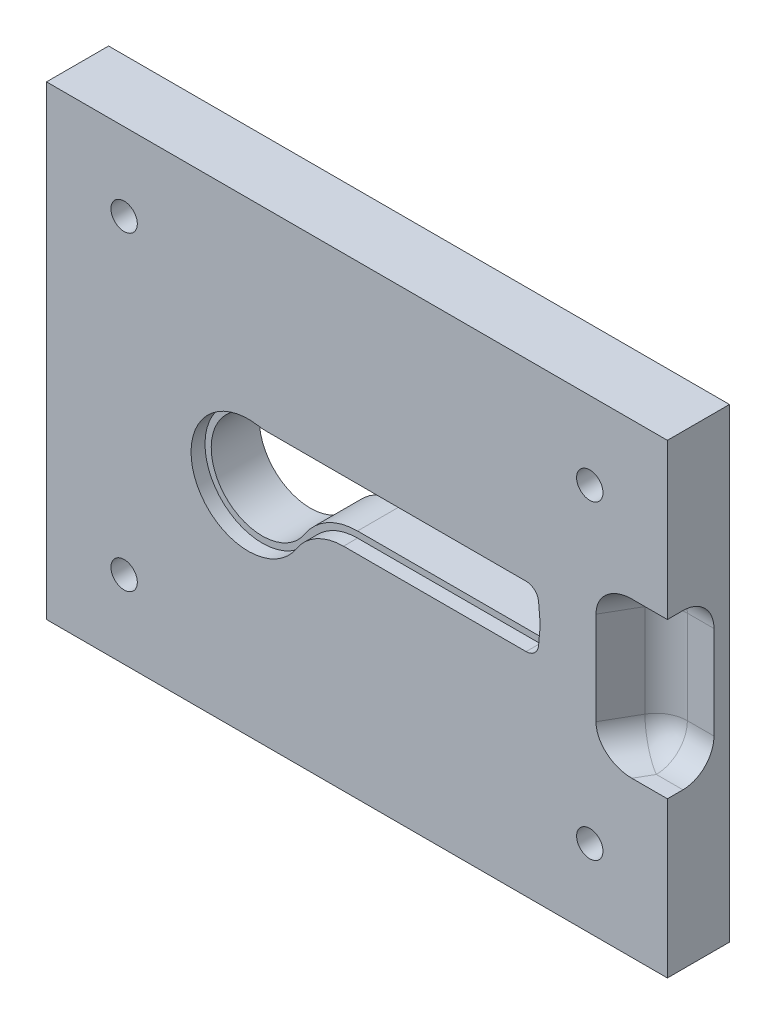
SolidWorks part; units mm, degrees
ref_plane "Plan1" through (0, 0, 0) normal (0, 0, 1) x (1, 0, 0)
ref_plane "Plan2" through (0, 0, 0) normal (0, 1, 0) x (1, 0, 0)
ref_plane "Plan3" through (0, 0, 0) normal (1, 0, 0) x (0, 0, -1)
sketch "Esquisse1" plane through (0, 0, 0) normal (0, 0, 1) x (1, 0, 0)
  line L1 (0, 0) -> (200, 0)
  line L2 (0, 0) -> (0, 150)
  line L3 (0, 150) -> (200, 150)
  line L4 (200, 0) -> (200, 150)
  dimension "D1" = 150
  dimension "D2" = 200
extrude "Base-Extrusion" add sketch "Esquisse1" along normal blind 20
sketch "Esquisse2" plane through (0, 0, 20) normal (0, 0, 1) x (1, 0, 0)
  line L0 (-10, 70) -> (90, 70) construction
  line L1 (0, 0) -> (200, 0) construction
  line L2 (20.3045, 78.12) -> (209.4484, 78.12) construction
  line L3 (71.0782, 85.935) -> (154.4898, 85.935)
  line L4 (156.5121, 84.0819) -> (157.0337, 78.12)
  line L5 (156.5121, 72.1581) -> (157.0337, 78.12)
  line L6 (95.6814, 70.305) -> (154.4898, 70.305)
  line L7 (200, 0) -> (200, 150) construction
  arc A0 (67.7404, 86.2151) -> (78.8329, 61.1069) centre (65, 70) ccw
  arc A1 (154.4898, 85.935) -> (156.5121, 84.0819) centre (154.4898, 83.905) cw
  arc A2 (71.0782, 85.935) -> (67.7404, 86.2151) centre (71.0782, 105.965) cw
  arc A3 (154.4898, 70.305) -> (156.5121, 72.1581) centre (154.4898, 72.335) ccw
  arc A4 (95.6814, 70.305) -> (78.8329, 61.1069) centre (95.6814, 50.275) ccw
  point P13 (156.35, 85.935)
  dimension "D2" = 32.89
  dimension "D6" = 91.35
  dimension "D7" = 2.03
  dimension "D8" = 20.03
  dimension "D9" = 20.03
  dimension "D10" = 135
  dimension "D1" = 70
  dimension "D3" = 8.12
  dimension "D4" = 7.815
  dimension "D5" = 95
extrude "Enlèv. mat.-Extru.1" cut sketch "Esquisse2" against normal through all
sketch "Esquisse10" plane through (0, 0, 20) normal (0, 0, 1) x (1, 0, 0)
  line L8 (158.5045, 71.9838) -> (159.0414, 78.12)
  line L9 (95.6814, 68.305) -> (154.4898, 68.305)
  line L10 (159.0414, 78.12) -> (158.5045, 84.2562)
  line L11 (154.4898, 87.935) -> (71.0782, 87.935)
  line L12 (158.5045, 71.9838) -> (159.0414, 78.12)
  line L13 (95.6814, 68.305) -> (154.4898, 68.305)
  line L14 (159.0414, 78.12) -> (158.5045, 84.2562)
  line L15 (154.4898, 87.935) -> (71.0782, 87.935)
  arc A10 (154.4898, 68.305) -> (158.5045, 71.9838) centre (154.4898, 72.335) ccw
  arc A11 (95.6814, 68.305) -> (80.5153, 60.0253) centre (95.6814, 50.275) ccw
  arc A12 (68.0737, 88.1871) -> (80.5153, 60.0253) centre (65, 70) ccw
  arc A13 (68.0737, 88.1871) -> (71.0782, 87.935) centre (71.0782, 105.965) ccw
  arc A14 (158.5045, 84.2562) -> (154.4898, 87.935) centre (154.4898, 83.905) ccw
  arc A15 (154.4898, 68.305) -> (158.5045, 71.9838) centre (154.4898, 72.335) ccw
  arc A16 (95.6814, 68.305) -> (80.5153, 60.0253) centre (95.6814, 50.275) ccw
  arc A17 (68.0737, 88.1871) -> (80.5153, 60.0253) centre (65, 70) ccw
  arc A18 (68.0737, 88.1871) -> (71.0782, 87.935) centre (71.0782, 105.965) ccw
  arc A19 (158.5045, 84.2562) -> (154.4898, 87.935) centre (154.4898, 83.905) ccw
  dimension "D1" = 2
extrude "Enlèv. mat.-Extru.9" cut sketch "Esquisse10" against normal blind 4.5
hole_wizard "Trou taraudé M10x1.52" positions "Esquisse15" profile "Esquisse14" tap size "M10x1.5" standard "ISO"
sketch "Esquisse15" plane through (0, 0, 20) normal (0, 0, 1) x (1, 0, 0)
  line L0 (0, 0) -> (200, 0) construction
  line L1 (200, 0) -> (200, 150) construction
  line L2 (200, 150) -> (0, 150) construction
  point P0 (175, 125)
  point P1 (25, 125)
  point P2 (25, 25)
  point P3 (175, 25)
  dimension "D1" = 100
  dimension "D2" = 25
  dimension "D3" = 150
  dimension "D4" = 150
  dimension "D5" = 100
  dimension "D6" = 25
  dimension "D7" = 25
  dimension "D8" = 25
sketch "Esquisse14" plane through (175, 125, 20) normal (1, 0, 0) x (0, -1, 0)
  line L0 (0, 0) -> (0, 20)
  line L1 (0, 20) -> (4.25, 20)
  line L2 (4.25, 20) -> (4.25, 0)
  line L5 (4.25, 0) -> (0, 0)
  line L11 (0, -6.35) -> (0, 107.95) construction
  dimension "Diamètre du perçage jusqu'au prochain" = 8.5
  dimension "Profondeur du perçage jusqu'au prochain" = 20
sketch "Esquisse16" plane through (0, 0, 0) normal (0, 0, -1) x (-1, 0, 0)
  circle A0 centre (-25, 125) radius 13
  circle A1 centre (-25, 25) radius 13
  circle A2 centre (-175, 25) radius 13
  circle A3 centre (-175, 125) radius 13
  dimension "D1" = 26
  dimension "D2" = 26
  dimension "D3" = 26
  dimension "D4" = 26
extrude "Enlèv. mat.-Extru.10" cut sketch "Esquisse16" against normal blind 5
sketch "Esquisse17" plane through (0, 0, 20) normal (0, 0, 1) x (1, 0, 0)
  line L0 (200, 0) -> (200, 150) construction
  line L1 (200, 100) -> (177, 100)
  line L2 (200, 100) -> (200, 50)
  line L3 (200, 50) -> (177, 50)
  line L4 (177, 100) -> (177, 50)
  line L5 (0, 0) -> (200, 0) construction
  dimension "D1" = 50
  dimension "D2" = 50
  dimension "D3" = 23
extrude "Enlèv. mat.-Extru.11" cut sketch "Esquisse17" against normal blind 15
draft "Dépouille1" type of draft neutral plane draft angle 30 faces to draft 1 parameters "D1"=30
fillet "Congé1" radius 10
sketch "Esquisse18" plane through (0, 0, 20) normal (0, 0, 1) x (1, 0, 0)
  line L0 (-8.1721, 125) -> (45, 125)
  line L1 (45, 125) -> (45, 70)
  line L2 (65, 70) -> (45, 70)
  line L3 (65, 70) -> (82.4134, 78.12)
  line L4 (82.4134, 78.12) -> (212.9104, 78.12)
  line L5 (0, 150) -> (0, 0) construction
  dimension "D1" = 45
  dimension "D2" = 25
  dimension "D3" = 8.12
